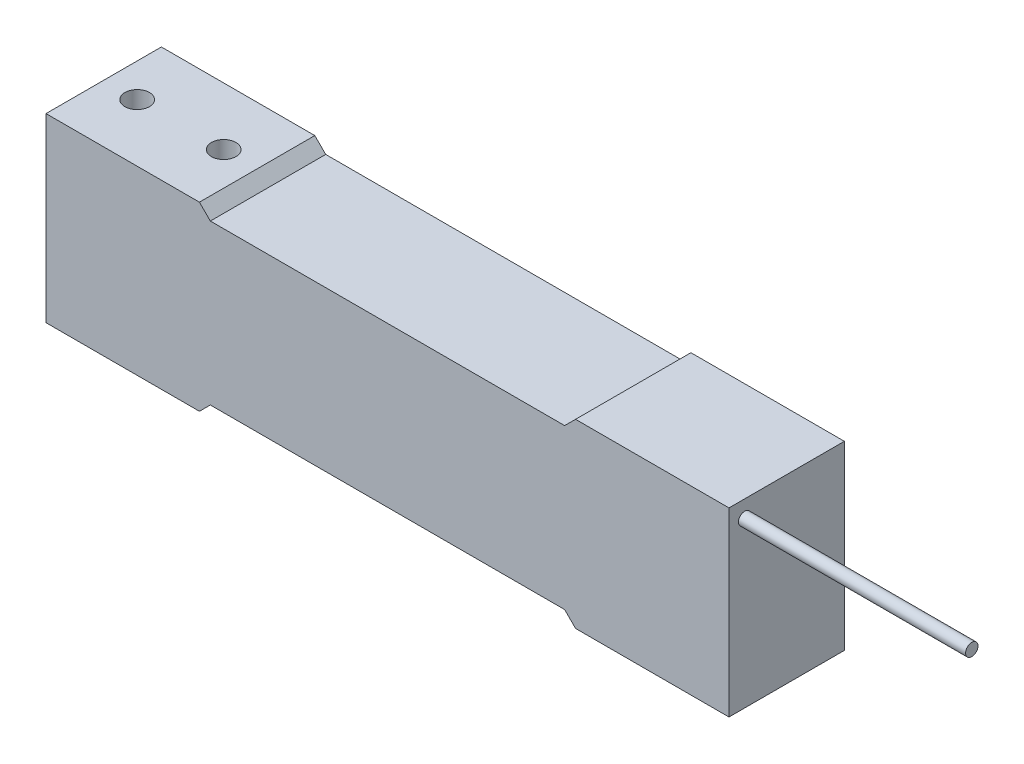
SolidWorks part; units mm, degrees
ref_plane "Front Plane" through (0, 0, 0) normal (0, 0, 1) x (1, 0, 0)
ref_plane "Top Plane" through (0, 0, 0) normal (0, 1, 0) x (1, 0, 0)
ref_plane "Right Plane" through (0, 0, 0) normal (1, 0, 0) x (0, 0, -1)
sketch "Sketch1" plane through (0, 0, 0) normal (0, 1, 0) x (1, 0, 0)
  line L1 (-75.184, 12.7) -> (75.184, 12.7)
  line L2 (-75.184, 12.7) -> (-75.184, -12.7)
  line L3 (-75.184, -12.7) -> (75.184, -12.7)
  line L4 (75.184, 12.7) -> (75.184, -12.7)
  line L5 (-75.184, 12.7) -> (75.184, -12.7) construction
  line L6 (-75.184, -12.7) -> (75.184, 12.7) construction
  point P0 (0, 0)
  dimension "D1" = 150.368
  dimension "D2" = 25.4
extrude "Extrude1" add sketch "Sketch1" along normal mid plane 39.878
sketch "Sketch3" plane through (0, 0, 12.7) normal (0, 0, 1) x (1, 0, 0)
  line L0 (-75.184, 19.939) -> (75.184, 19.939) construction
  line L1 (-39.002, 17.539) -> (39.002, 17.539)
  line L2 (-41.402, 19.939) -> (41.402, 19.939)
  line L3 (41.402, 19.939) -> (39.002, 17.539)
  line L6 (-41.402, 19.939) -> (-39.002, 17.539)
  line L10 (0, 31.077) -> (0, -23.961) construction
  point P6 (0, 19.939)
  point P9 (0, 17.539)
  dimension "D1" = 45
  dimension "D2" = 2.4
extrude "Extrude2" cut sketch "Sketch3" against normal through all
sketch "Sketch6" plane through (0, 19.939, 0) normal (0, 1, 0) x (1, 0, 0)
  line L0 (-75.184, 0) -> (-41.402, 0) construction
  line L1 (-75.184, 12.7) -> (-75.184, -12.7) construction
  line L2 (-41.402, 12.7) -> (-41.402, -12.7) construction
  line L3 (-58.293, 12.7) -> (-58.293, -12.7) construction
  line L4 (-41.402, 12.7) -> (-75.184, 12.7) construction
  line L5 (-75.184, -12.7) -> (-41.402, -12.7) construction
  point P12 (-67.818, 0)
  dimension "D1" = 9.525
hole_wizard "1/4-28 Tapped Hole2" positions "3DSketch2" profile "Sketch7" tap size "1/4-28" standard "Ansi Inch"
sketch3d "3DSketch2"
  point P0 (-67.818, 19.939, 0)
sketch "Sketch7" plane through (-67.818, 19.939, 0) normal (1, 0, 0) x (0, 0, 1)
  line L0 (0, 0) -> (0, 12.8014)
  line L1 (0, 12.8014) -> (2.7051, 11.176)
  line L2 (2.7051, 11.176) -> (2.7051, 0)
  line L5 (2.7051, 0) -> (0, 0)
  line L10 (0, 12.8014) -> (-2.7051, 11.176) construction
  line L11 (0, -6.35) -> (0, 107.95) construction
  dimension "Tap Drill Dia." = 5.4102
  dimension "Tap Drill Depth" = 11.176
  dimension "Drill Angle" = 118
ref_plane "Plane2" through (-58.293, 0, 0) normal (1, 0, 0) x (0, 0, -1)
mirror "Mirror3" about plane through (-58.293, 0, 0) normal (1, 0, 0) of "1/4-28 Tapped Hole2"
mirror "Mirror4" about plane through (0, 0, 0) normal (0, 1, 0) of "Extrude2"
sketch "Sketch8" plane through (0, -19.939, 0) normal (0, -1, 0) x (1, 0, 0)
  line L0 (41.402, 0) -> (75.184, 0) construction
  line L1 (41.402, -12.7) -> (41.402, 12.7) construction
  line L2 (75.184, 12.7) -> (75.184, -12.7) construction
  line L3 (58.293, 12.7) -> (58.293, -12.7) construction
  line L4 (41.402, 12.7) -> (75.184, 12.7) construction
  line L5 (75.184, -12.7) -> (41.402, -12.7) construction
  point P12 (48.768, 0)
  dimension "D1" = 9.525
hole_wizard "1/4-28 Tapped Hole3" positions "3DSketch3" profile "Sketch9" tap size "1/4-28" standard "Ansi Inch"
sketch3d "3DSketch3"
  point P0 (48.768, -19.939, 0)
sketch "Sketch9" plane through (48.768, -19.939, 0) normal (1, 0, 0) x (0, 0, -1)
  line L0 (0, 0) -> (0, 12.8014)
  line L1 (0, 12.8014) -> (2.7051, 11.176)
  line L2 (2.7051, 11.176) -> (2.7051, 0)
  line L5 (2.7051, 0) -> (0, 0)
  line L10 (0, 12.8014) -> (-2.7051, 11.176) construction
  line L11 (0, -6.35) -> (0, 107.95) construction
  dimension "Tap Drill Dia." = 5.4102
  dimension "Tap Drill Depth" = 11.176
  dimension "Drill Angle" = 118
ref_plane "Plane3" through (58.293, 0, 0) normal (1, 0, 0) x (0, 0, -1)
mirror "Mirror6" about plane through (58.293, 0, 0) normal (1, 0, 0) of "1/4-28 Tapped Hole3"
sketch "Sketch10" plane through (75.184, 0, 0) normal (1, 0, 0) x (0, 0, -1)
  circle A0 centre (-9.2445, 16.2079) radius 1.3677
extrude "Extrude4" add sketch "Sketch10" along normal blind 50
